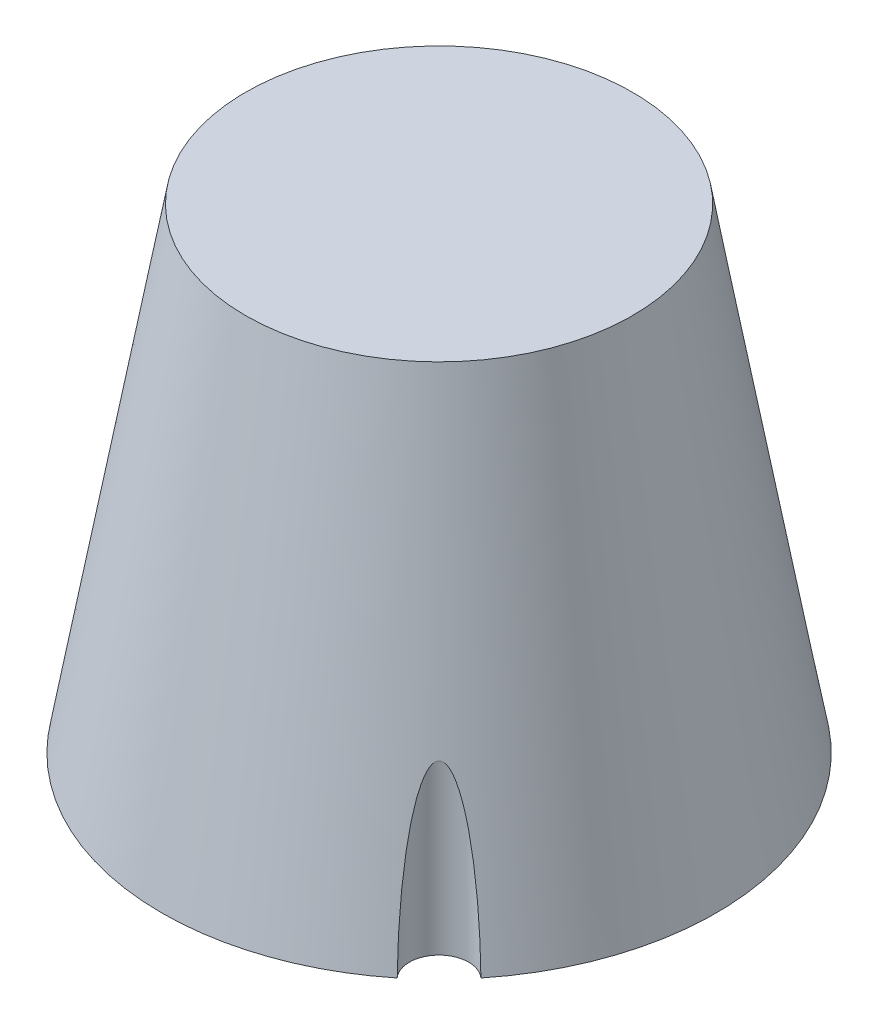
SolidWorks part; units mm, degrees
ref_plane "Front Plane" through (0, 0, 0) normal (0, 0, 1) x (1, 0, 0)
ref_plane "Top Plane" through (0, 0, 0) normal (0, 1, 0) x (1, 0, 0)
ref_plane "Right Plane" through (0, 0, 0) normal (1, 0, 0) x (0, 0, -1)
sketch "Sketch1" plane through (0, 0, 0) normal (0, 1, 0) x (1, 0, 0)
  circle A0 centre (0, 0) radius 35
  dimension "D1" = 70
extrude "Extrude1" add sketch "Sketch1" along normal blind 60 draft 10
ref_plane "Plane1" through (0, 0, 0) normal (0.7071, 0, -0.7071) x (-0.7071, 0, -0.7071)
sketch "Sketch2" plane through (0, 0, 0) normal (0.7071, 0, -0.7071) x (-0.7071, 0, -0.7071)
  line L1 (-24.4204, 60) -> (-35, 0) construction
  line L2 (-24.4204, 60) -> (-35, 0)
sketch "Sketch3" plane through (0, 0, 0) normal (0, -1, 0) x (1, 0, 0)
  circle A0 centre (24.7487, 24.7487) radius 3.7415
extrude "Cut-Extrude1" cut sketch "Sketch3" along a picked direction on the side against the normal blind 60
